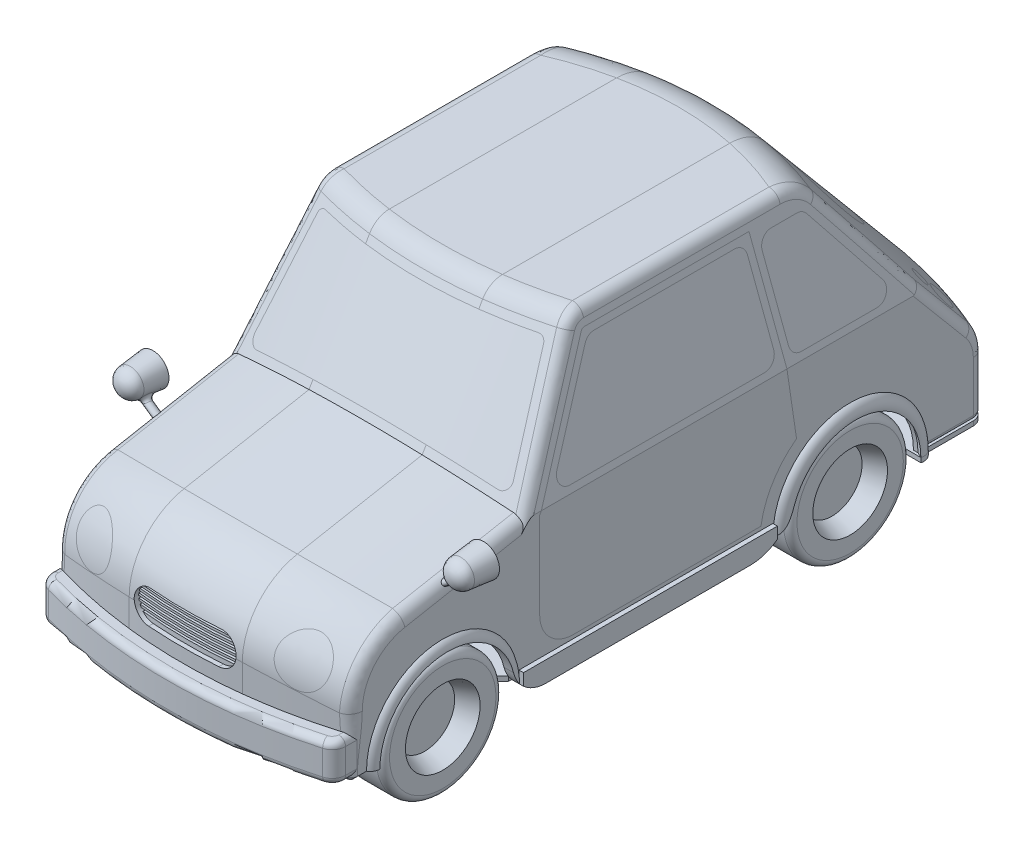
SolidWorks part; units mm, degrees
ref_plane "正面" through (0, 0, 0) normal (0, 0, 1) x (1, 0, 0)
ref_plane "平面" through (0, 0, 0) normal (0, 1, 0) x (1, 0, 0)
ref_plane "右側面" through (0, 0, 0) normal (1, 0, 0) x (0, 0, -1)
imported_body "ｲﾝﾎﾟｰﾄ1"
ref_plane "平面1" through (0, 0, 65) normal (0, 0, 1) x (1, 0, 0)
sketch "ｽｹｯﾁ1" plane through (0, 0, 65) normal (0, 0, 1) x (1, 0, 0)
  circle A0 centre (0, 0) radius 26.5
  circle A1 centre (179.9666, 0) radius 26.5
  dimension "D1" = 53
extrude "ﾎﾞｽ - 押し出し1" add sketch "ｽｹｯﾁ1" against normal blind 20 separate body
sketch "ｽｹｯﾁ2" plane through (0, 0, 65) normal (0, 0, 1) x (1, 0, 0)
  circle A2 centre (0, 0) radius 16.5
  circle A3 centre (0, 0) radius 16.5
  circle A5 centre (179.9666, 0) radius 16.5
  circle A6 centre (179.9666, 0) radius 16.5
  dimension "D1" = 10
  dimension "D2" = 10
extrude "ｶｯﾄ - 押し出し1" cut sketch "ｽｹｯﾁ2" against normal blind 8 draft 22
fillet "ﾌｨﾚｯﾄ1" radius 3 2 edges at (26.5, 0, 65) (26.5, 0, 45)
fillet "ﾌｨﾚｯﾄ2" radius 3 2 edges at (206.4666, 0, 65) (206.4666, 0, 45)
mirror "ﾐﾗｰ1" about plane through (0, 0, 0) normal (0, 0, 1)
sketch "ｽｹｯﾁ3" plane through (0, 0, 0) normal (0, -1, 0) x (1, 0, 0)
  line L0 (-37.7864, 65) -> (-33.686, 65) construction
  line L1 (-30, 67.1936) -> (-30, 63) construction
  line L2 (-37.7864, 65) -> (-33.686, 65)
  line L3 (-30, 67.1936) -> (-30, 43.2187)
  line L4 (29.0899, 63) -> (29.0899, 67.1936) construction
  line L6 (29.0899, 43.2187) -> (29.0899, 60)
  line L8 (-30, 43.2187) -> (29.0899, 43.2187)
  line L9 (150.3647, 60) -> (150.3647, 43.2187)
  line L10 (150.3647, 43.2187) -> (208.7408, 43.2187)
  line L11 (208.7408, 67.4685) -> (208.7408, 43.2187)
  line L12 (214.0446, 65) -> (234.3862, 65) construction
  line L13 (214.0446, 65) -> (234.3862, 65)
  line L14 (-50, 0) -> (250, 0)
  line L15 (133.8896, 60) -> (43.6348, 60) construction
  line L16 (150.3647, 60) -> (29.0899, 60)
  arc A0 (-37.7864, 65) -> (-40.6591, 62.8705) centre (-37.7864, 61.9976) ccw construction
  arc A1 (-40.6591, 62.8705) -> (-48.5501, 25) centre (166.25, 0) ccw construction
  arc A2 (-30, 67.1936) -> (-33.686, 65) centre (-30, 63) ccw construction
  arc A3 (-37.7864, 65) -> (-40.6591, 62.8705) centre (-37.7864, 61.9976) ccw
  arc A4 (-40.6591, 62.8705) -> (-48.5501, 25) centre (166.25, 0) ccw
  arc A5 (-30, 67.1936) -> (-33.686, 65) centre (-30, 63) ccw
  arc A6 (214.5581, 63) -> (208.7408, 67.4685) centre (209.9333, 63) ccw construction
  arc A7 (239.0828, 61.7153) -> (234.3862, 65) centre (234.3862, 60) ccw construction
  arc A8 (248.2544, 25) -> (239.0828, 61.7153) centre (70.102, 0) ccw construction
  arc A9 (214.1033, 65) -> (208.7408, 67.4685) centre (209.9333, 63) ccw
  arc A10 (239.0828, 61.7153) -> (234.3862, 65) centre (234.3862, 60) ccw
  arc A11 (248.2544, 25) -> (239.0828, 61.7153) centre (70.102, 0) ccw
  arc A12 (-48.5501, 25) -> (-48.5501, -25) centre (166.25, 0) ccw construction
  arc A13 (248.2544, -25) -> (248.2544, 25) centre (70.102, 0) ccw construction
  arc A14 (-48.5501, 25) -> (-50, 0) centre (166.25, 0) ccw
  arc A15 (250, 0) -> (248.2544, 25) centre (70.102, 0) ccw
extrude "ﾎﾞｽ - 押し出し3" add sketch "ｽｹｯﾁ3" along normal blind 2 separate body
chamfer "面取り1" distance 5 angle 45 2 edges at (29.0899, -1, 60) (150.3647, -1, 60)
mirror "ﾐﾗｰ2" about plane through (0, 0, 0) normal (0, 0, 1)
sketch "ｽｹｯﾁ4" plane through (0, 0, 0) normal (0, -1, 0) x (1, 0, 0)
  line L0 (-47.3567, 64.9056) -> (-37.7864, 65)
  line L1 (-47.356, -64.9079) -> (-37.7886, -65)
  arc A6 (-37.7864, 65) -> (-40.6591, 62.8705) centre (-37.7864, 61.9976) ccw construction
  arc A7 (-40.6591, 62.8705) -> (-48.5501, 25) centre (166.25, 0) ccw construction
  arc A8 (-48.5501, 25) -> (-48.5501, -25) centre (166.25, 0) ccw construction
  arc A9 (-55.5031, -25.8092) -> (-47.356, -64.9079) centre (166.25, 0) ccw
  arc A10 (-55.5031, 25.8092) -> (-55.5031, -25.8092) centre (166.25, 0) ccw
  arc A11 (-47.3567, 64.9056) -> (-55.5031, 25.8092) centre (166.25, 0) ccw
  arc A12 (-55.5031, -25.8092) -> (-47.356, -64.9079) centre (166.25, 0) ccw
  arc A13 (-55.5031, 25.8092) -> (-55.5031, -25.8092) centre (166.25, 0) ccw
  arc A14 (-47.3567, 64.9056) -> (-55.5031, 25.8092) centre (166.25, 0) ccw
  arc A15 (-48.5501, -25) -> (-40.6584, -62.8727) centre (166.25, 0) ccw construction
  arc A16 (-40.6584, -62.8727) -> (-37.7886, -65) centre (-37.7886, -62.0006) ccw construction
  arc A17 (-37.7864, 65) -> (-40.6591, 62.8705) centre (-37.7864, 61.9976) ccw
  arc A18 (-40.6591, 62.8705) -> (-48.5501, 25) centre (166.25, 0) ccw
  arc A19 (-48.5501, 25) -> (-48.5501, -25) centre (166.25, 0) ccw
  arc A20 (-48.5501, -25) -> (-40.6584, -62.8727) centre (166.25, 0) ccw
  arc A21 (-40.6584, -62.8727) -> (-37.7886, -65) centre (-37.7886, -62.0006) ccw
  dimension "D1" = 7
extrude "ﾎﾞｽ - 押し出し4" add sketch "ｽｹｯﾁ4" against normal blind 17 separate body
fillet "ﾌｨﾚｯﾄ3" radius 6 2 edges at (-47.356, 8.5, -64.9079) (-47.3567, 8.5, 64.9056)
move or copy body "ﾎﾞﾃﾞｨ-移動/ｺﾋﾟｰ4" bodies to move or copy 101 104 110 108 109 106 107 105 copy no rotation origin (76.7017, 0, 0) rotation axis (0, 1, 0) rotation angle 90
fillet "ﾌｨﾚｯﾄ4" radius 3 10 edges at (140.4173, 0, 123.196) (12.9844, 0, 123.1951) (140.4173, 17, 123.196) (12.9844, 17, 123.1951) (76.701, 0, 133.7017) (76.701, 17, 133.7017)
ref_plane "平面2" through (0, 0, 133.7017) normal (0, 0, 1) x (1, 0, 0)
sketch "ナンバープレート" plane through (0, 0, 133.7017) normal (0, 0, 1) x (1, 0, 0)
  line L1 (57.209, -4.7414) -> (98.0508, -4.7414)
  line L2 (57.209, -4.7414) -> (57.209, 12.5239)
  line L3 (57.209, 12.5239) -> (98.0508, 12.5239)
  line L4 (98.0508, -4.7414) -> (98.0508, 12.5239)
